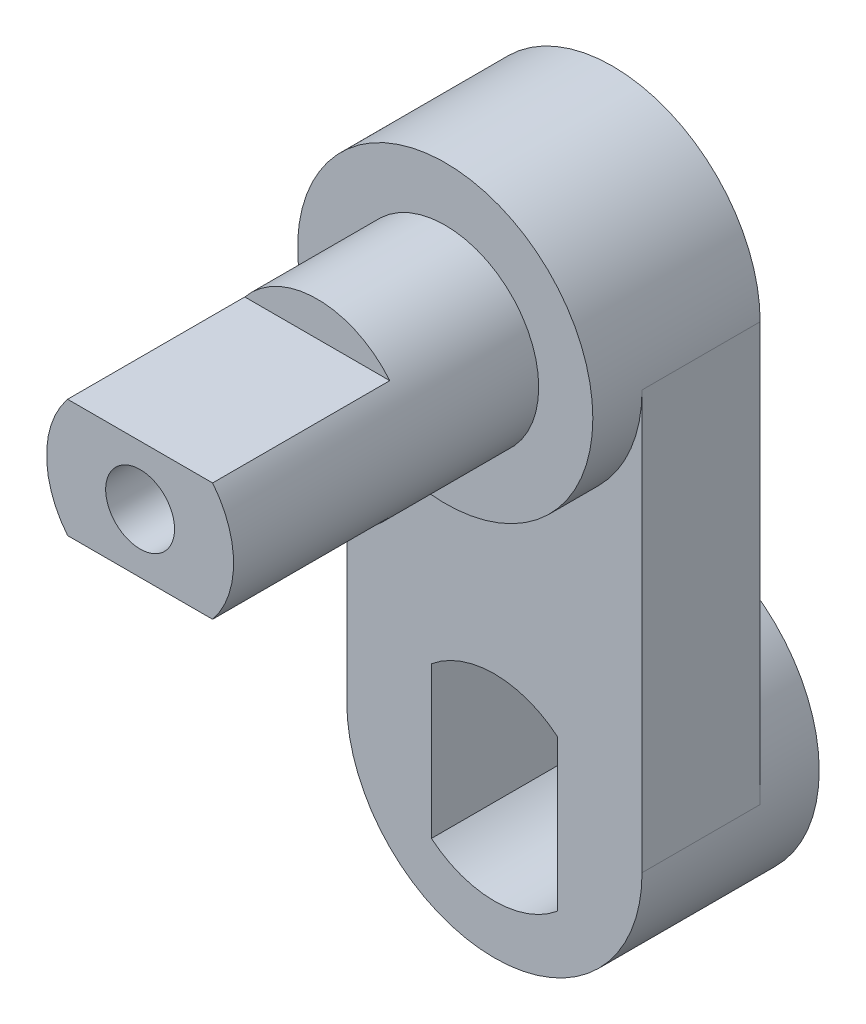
SolidWorks part; units mm, degrees
ref_plane "Plan de face" through (0, 0, 0) normal (0, 0, 1) x (1, 0, 0)
ref_plane "Plan de dessus" through (0, 0, 0) normal (0, 1, 0) x (1, 0, 0)
ref_plane "Plan de droite" through (0, 0, 0) normal (1, 0, 0) x (0, 0, -1)
sketch "Esquisse1" plane through (0, 0, 0) normal (0, 0, 1) x (1, 0, 0)
  line L0 (0, 0) -> (3.2, 0) construction
  line L1 (0, 0) -> (-3.2, 0) construction
  line L2 (-3.2, 0) -> (-3.2, 3.8419)
  line L3 (-3.2, 0) -> (-3.2, -3.8419)
  line L4 (3.2, 0) -> (3.2, 3.8419)
  line L5 (3.2, 0) -> (3.2, -3.8419)
  arc A0 (-3.2, -3.8419) -> (3.2, -3.8419) centre (0, 0) ccw
  circle A1 centre (0, 0) radius 7.5
  arc A2 (3.2, 3.8419) -> (-3.2, 3.8419) centre (0, 0) ccw
  dimension "D1" = 10
  dimension "D2" = 15
  dimension "D3" = 3.2
  dimension "D4" = 3.2
extrude "Boss.-Extru.1" add sketch "Esquisse1" along normal blind 9
sketch "Esquisse2" plane through (0, 0, 9) normal (0, 0, 1) x (1, 0, 0)
  line L0 (0, 0) -> (0, 21.24)
  line L1 (7.5, 21.24) -> (7.5, 0)
  line L2 (-7.5, 21.24) -> (-7.5, 0)
  arc A0 (7.5, 21.24) -> (-7.5, 21.24) centre (0, 21.24) ccw
  circle A1 centre (0, 0) radius 7.5 construction
  arc A2 (-7.5, 0) -> (7.5, 0) centre (0, 0) ccw
  dimension "D2" = 15
  dimension "D1" = 21.24
  dimension "D3" = 21.24
  dimension "D4" = 21.24
extrude "Boss.-Extru.2" add sketch "Esquisse2" against normal blind 6
sketch "Esquisse4" plane through (0, 0, 9) normal (0, 0, 1) x (1, 0, 0)
  circle A0 centre (0, 21.24) radius 7.5
  dimension "D1" = 15
extrude "Boss.-Extru.3" add sketch "Esquisse4" along normal blind 2.5
sketch "Esquisse5" plane through (0, 0, 11.5) normal (0, 0, 1) x (1, 0, 0)
  circle A0 centre (0, 21.24) radius 4.75
  dimension "D1" = 9.5
extrude "Boss.-Extru.4" add sketch "Esquisse5" along normal blind 6.5
sketch "Esquisse6" plane through (0, 0, 18) normal (0, 0, 1) x (1, 0, 0)
  line L0 (0, 21.24) -> (0, 16.49) construction
  line L1 (0, 21.24) -> (-4.75, 21.24)
  line L2 (0, 21.24) -> (0, 18.24)
  line L3 (0, 21.24) -> (0, 24.24)
  line L4 (0, 24.24) -> (3.6827, 24.24)
  line L5 (0, 24.24) -> (-3.6827, 24.24)
  line L6 (0, 18.24) -> (3.6827, 18.24)
  line L7 (0, 18.24) -> (-3.6827, 18.24)
  circle A0 centre (0, 21.24) radius 4.75 construction
  circle A1 centre (0, 21.24) radius 4.75 construction
  dimension "D1" = 90
  dimension "D2" = 90
  dimension "D3" = 90
  dimension "D4" = 3
  dimension "D5" = 3
extrude "Boss.-Extru.5" add sketch "Esquisse6" along normal blind 9 contours L2 L6 L4 L3 M5 | L3 L5 L1 M5 | L0 L1 L7 M5
sketch "Esquisse7" plane through (0, 0, 27) normal (0, 0, 1) x (1, 0, 0)
  circle A0 centre (0, 21.24) radius 1.75
  dimension "D1" = 3.5
extrude "Enlèv. mat.-Extru.1" cut sketch "Esquisse7" against normal blind 37
chamfer "Chanfrein1" distance 1.5 angle 45 1 edges at (1.75, 21.24, 3)
